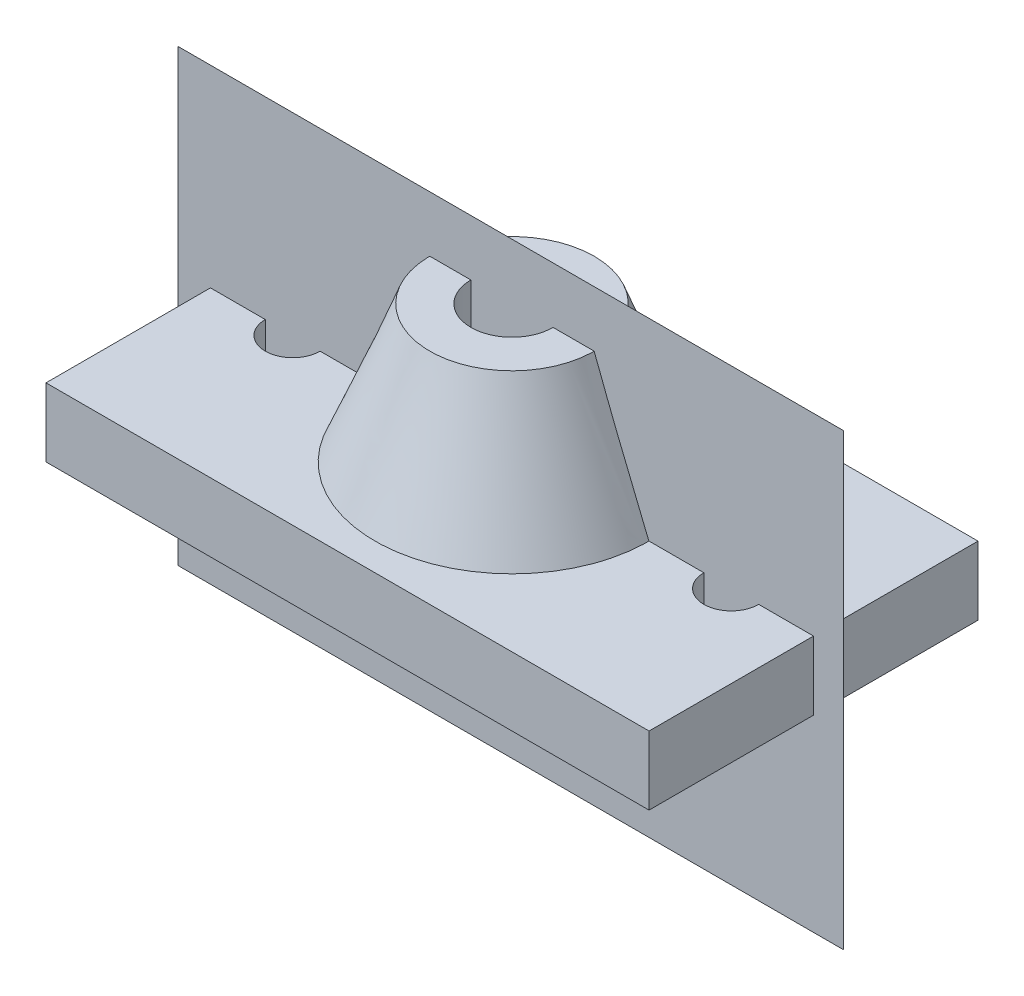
SolidWorks part; units mm, degrees
ref_plane "Front" through (0, 0, 0) normal (0, 0, 1) x (1, 0, 0)
ref_plane "Top" through (0, 0, 0) normal (0, 1, 0) x (1, 0, 0)
ref_plane "Right" through (0, 0, 0) normal (1, 0, 0) x (0, 0, -1)
sketch "Sketch1" plane through (0, 0, 0) normal (0, 1, 0) x (1, 0, 0)
  line L0 (-69.85, -38.1) -> (69.85, 38.1) construction
  line L1 (-69.85, -38.1) -> (69.85, -38.1)
  line L2 (-69.85, -38.1) -> (-69.85, 38.1)
  line L3 (-69.85, 38.1) -> (69.85, 38.1)
  line L4 (69.85, -38.1) -> (69.85, 38.1)
  dimension "D1" = 76.2
  dimension "D2" = 139.7
extrude "Base-Extrude" add sketch "Sketch1" along normal blind 15.875
sketch "Sketch2" plane through (0, 15.875, 0) normal (0, 1, 0) x (-1, 0, 0)
  circle A0 centre (0, 0) radius 31.75
  dimension "D1" = 63.5
ref_plane "Plane1" through (0, 47.625, 0) normal (0, 1, 0) x (-1, 0, 0)
sketch "Sketch3" plane through (0, 47.625, 0) normal (0, 1, 0) x (-1, 0, 0)
  circle A0 centre (0, 0) radius 19.05
  dimension "D1" = 38.1
loft "Boss-Loft1" add profiles "Sketch3", "Sketch2"
sketch "Sketch4" plane through (0, 47.625, 0) normal (0, 1, 0) x (-1, 0, 0)
  circle A0 centre (0, 0) radius 9.525
  dimension "D1" = 19.05
extrude "Cut-Extrude1" cut sketch "Sketch4" against normal through all
sketch "Sketch5" plane through (0, 15.875, 0) normal (0, 1, 0) x (-1, 0, 0)
  line L0 (0, -44.9768) -> (0, 48.3239) construction
  circle A0 centre (-50.8, 0) radius 6.35
  circle A1 centre (50.8, 0) radius 6.35
  dimension "D1" = 12.7
  dimension "D2" = 101.6
extrude "Cut-Extrude2" cut sketch "Sketch5" against normal through all
sketch "Sketch6" plane through (0, 0, 0) normal (0, -1, 0) x (1, 0, 0)
  line L0 (-38.1, -25.4) -> (38.1, 25.4) construction
  line L1 (-31.75, -25.4) -> (31.75, -25.4)
  line L2 (-38.1, -19.05) -> (-38.1, 19.05)
  line L3 (-31.75, 25.4) -> (31.75, 25.4)
  line L4 (38.1, -19.05) -> (38.1, 19.05)
  arc A0 (-31.75, 25.4) -> (-38.1, 19.05) centre (-31.75, 19.05) ccw
  arc A1 (-38.1, -19.05) -> (-31.75, -25.4) centre (-31.75, -19.05) ccw
  arc A2 (38.1, -19.05) -> (31.75, -25.4) centre (31.75, -19.05) cw
  arc A3 (38.1, 19.05) -> (31.75, 25.4) centre (31.75, 19.05) ccw
  point P7 (-38.1, 25.4)
  dimension "D3" = 6.35
  dimension "D1" = 76.2
  dimension "D2" = 50.8
extrude "Cut-Extrude3" cut sketch "Sketch6" against normal blind 3.175
sketch "Sketch7" plane through (0, 0, 0) normal (0, 0, 1) x (1, 0, 0)
  line L1 (-77.4019, -43.5865) -> (76.7743, -43.5865)
  line L2 (-77.4019, -43.5865) -> (-77.4019, 60.5612)
  line L3 (-77.4019, 60.5612) -> (76.7743, 60.5612)
  line L4 (76.7743, -43.5865) -> (76.7743, 60.5612)
surface "Surface-Plane1" sketch "Sketch7"
